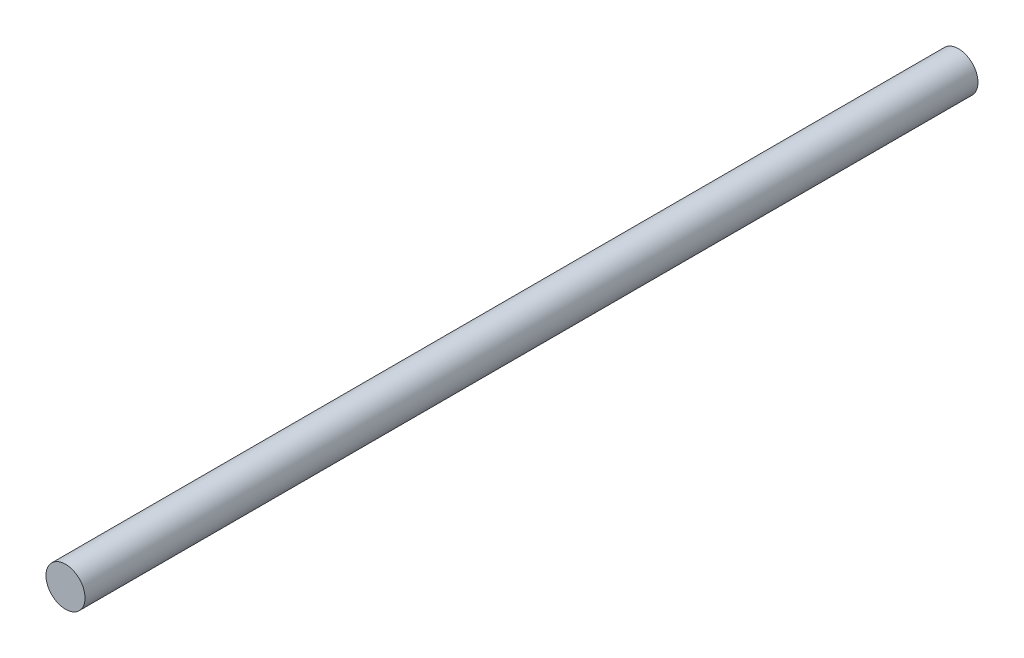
SolidWorks part; units mm, degrees
ref_plane "Front Plane" through (0, 0, 0) normal (0, 0, 1) x (1, 0, 0)
ref_plane "Top Plane" through (0, 0, 0) normal (0, 1, 0) x (1, 0, 0)
ref_plane "Right Plane" through (0, 0, 0) normal (1, 0, 0) x (0, 0, -1)
sketch "Sketch1" plane through (0, 0, 0) normal (0, 0, 1) x (1, 0, 0)
  circle A0 centre (0, 0) radius 5
  dimension "D1" = 10
extrude "Boss-Extrude1" add sketch "Sketch1" along normal blind 228.6
